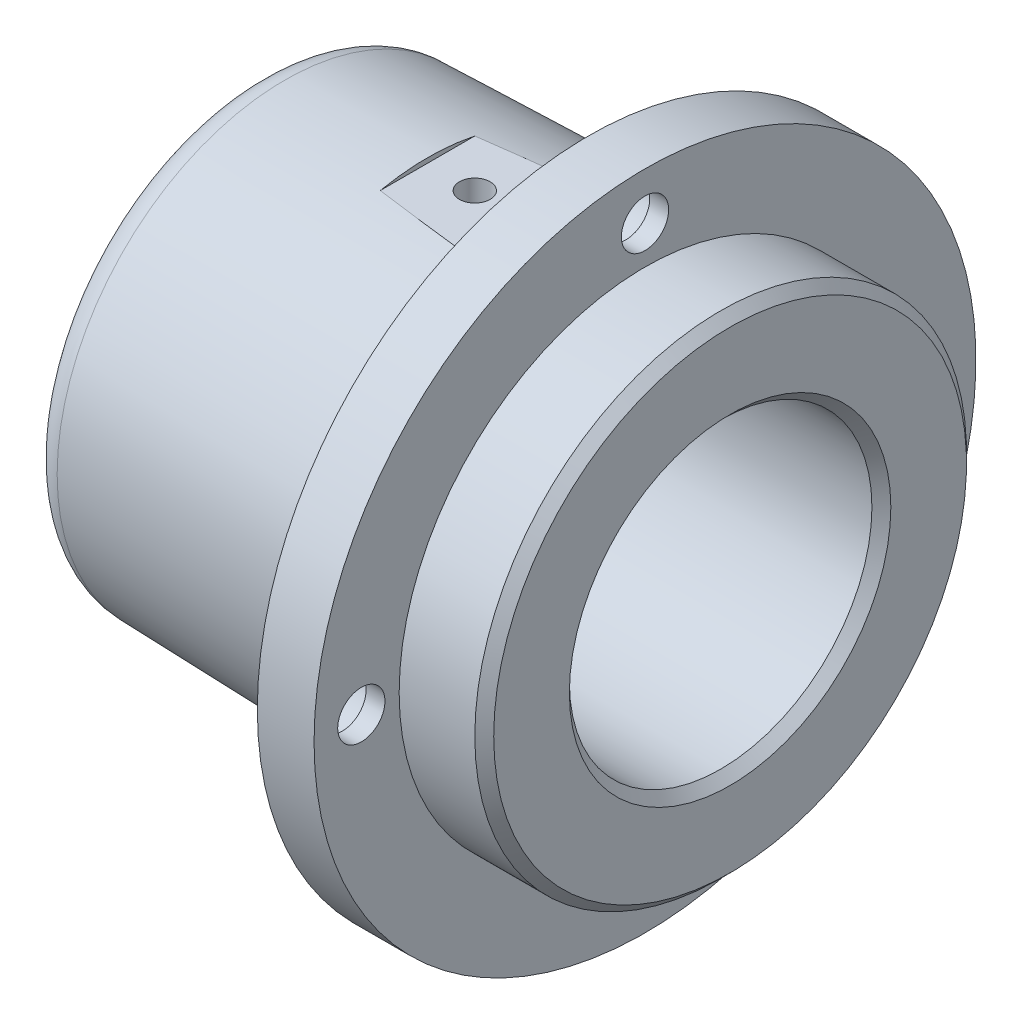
SolidWorks part; units mm, degrees
ref_plane "face" through (0, 0, 0) normal (0, 0, 1) x (1, 0, 0)
ref_plane "dessus" through (0, 0, 0) normal (0, 1, 0) x (1, 0, 0)
ref_plane "profil" through (0, 0, 0) normal (1, 0, 0) x (0, 0, -1)
sketch "Esquisse1" plane through (0, 0, 0) normal (0, 0, 1) x (1, 0, 0)
  line L0 (0, 16) -> (0, 24)
  line L1 (0, 24) -> (35, 25)
  line L2 (35, 25) -> (35, 35)
  line L3 (35, 35) -> (41, 35)
  line L4 (41, 35) -> (41, 26)
  line L5 (41, 26) -> (50, 26)
  line L6 (50, 26) -> (50, 16)
  line L7 (-12.3084, 0) -> (63.6958, 0) construction
  line L8 (0, 16) -> (50, 16)
  dimension "D1" = 16
  dimension "D2" = 9
  dimension "D3" = 6
  dimension "D4" = 24
  dimension "D5" = 50
  dimension "D6" = 25
  dimension "D7" = 35
  dimension "D8" = 26
revolve "Base-Révolution" add sketch "Esquisse1" angle 360 about L7
fillet "Congé1" radius 3 1 edges at (0, 0, 24)
fillet "Congé3" radius 1 1 edges at (35, 0, 25)
chamfer "Chanfrein1" distance 1 angle 45 3 edges at (0, 0, 16) (50, 0, 16) (50, 0, 26)
sketch "Esquisse8" plane through (35, 0, 0) normal (-1, 0, 0) x (0, 0, 1)
  circle A0 centre (0, 30) radius 4
  circle A1 centre (0, 0) radius 35 construction
  dimension "D1" = 8
  dimension "D2" = 30
extrude "Enlèv. mat.-Extru.1" cut sketch "Esquisse8" against normal blind 4
sketch "Esquisse9" plane through (39, 0, 0) normal (-1, 0, 0) x (0, 0, 1)
  circle A0 centre (0, 30) radius 2.5
  dimension "D1" = 5
extrude "Enlèv. mat.-Extru.2" cut sketch "Esquisse9" against normal through all
pattern_circular "Répétition circulaire1" count 4 over 360 about axis through (0, 0, 0) along (1, 0, 0) of "Enlèv. mat.-Extru.2", "Enlèv. mat.-Extru.1"
sketch "Esquisse10" plane through (0, 0, 0) normal (0, 0, 1) x (1, 0, 0)
  line L0 (-12.3084, 0) -> (63.6958, 0) construction
  line L1 (18, 27.9907) -> (28, 27.9907)
  line L2 (18, 27.9907) -> (18, 24)
  line L3 (18, 24) -> (28, 24)
  line L4 (28, 27.9907) -> (28, 24)
  line L5 (0, 21.0845) -> (0, -21.0845) construction
  dimension "D1" = 24
  dimension "D2" = 28
  dimension "D3" = 10
extrude "Enlèv. mat.-Extru.3" cut sketch "Esquisse10" against normal mid plane 50
sketch "Esquisse11" plane through (0, 24, 0) normal (0, 1, 0) x (-1, 0, 0)
  line L0 (-49, 0) -> (-50, 0) construction
  line L2 (-41, 35) -> (-41, -35) construction
  circle A0 centre (-23, 0) radius 1.622
  dimension "D2" = 3.244
  dimension "D1" = 18
extrude "Enlèv. mat.-Extru.4" cut sketch "Esquisse11" against normal up to next
sketch "Esquisse12" plane through (0, 0, 0) normal (-1, 0, 0) x (0, 0, 1)
  line L0 (0, 15.9176) -> (0, 24) construction
  line L1 (0, 36.921) -> (36.921, 36.921)
  line L2 (0, 36.921) -> (0, 0)
  line L3 (0, 0) -> (36.921, 0)
  line L4 (36.921, 36.921) -> (36.921, 0)
extrude "Enlèv. mat.-Extru.5" cut sketch "Esquisse12" against normal through all
